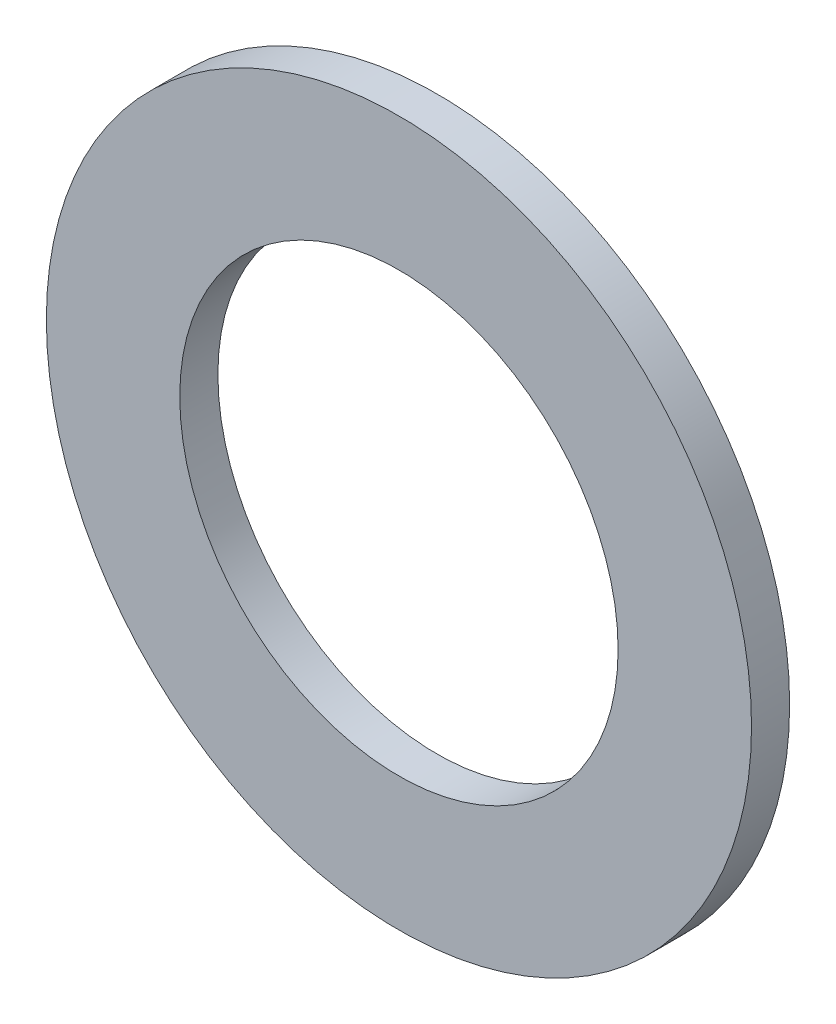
SolidWorks part; units mm, degrees
ref_plane "Plan de face" through (0, 0, 0) normal (0, 0, 1) x (1, 0, 0)
ref_plane "Plan de dessus" through (0, 0, 0) normal (0, 1, 0) x (1, 0, 0)
ref_plane "Plan de droite" through (0, 0, 0) normal (1, 0, 0) x (0, 0, -1)
sketch "Esquisse1" plane through (0, 0, 0) normal (0, 0, 1) x (1, 0, 0)
  circle A0 centre (0, 0) radius 11.5
  circle A1 centre (0, 0) radius 18.5
  dimension "D1" = 23
  dimension "D2" = 37
extrude "Extrusion1" add sketch "Esquisse1" along normal blind 2
